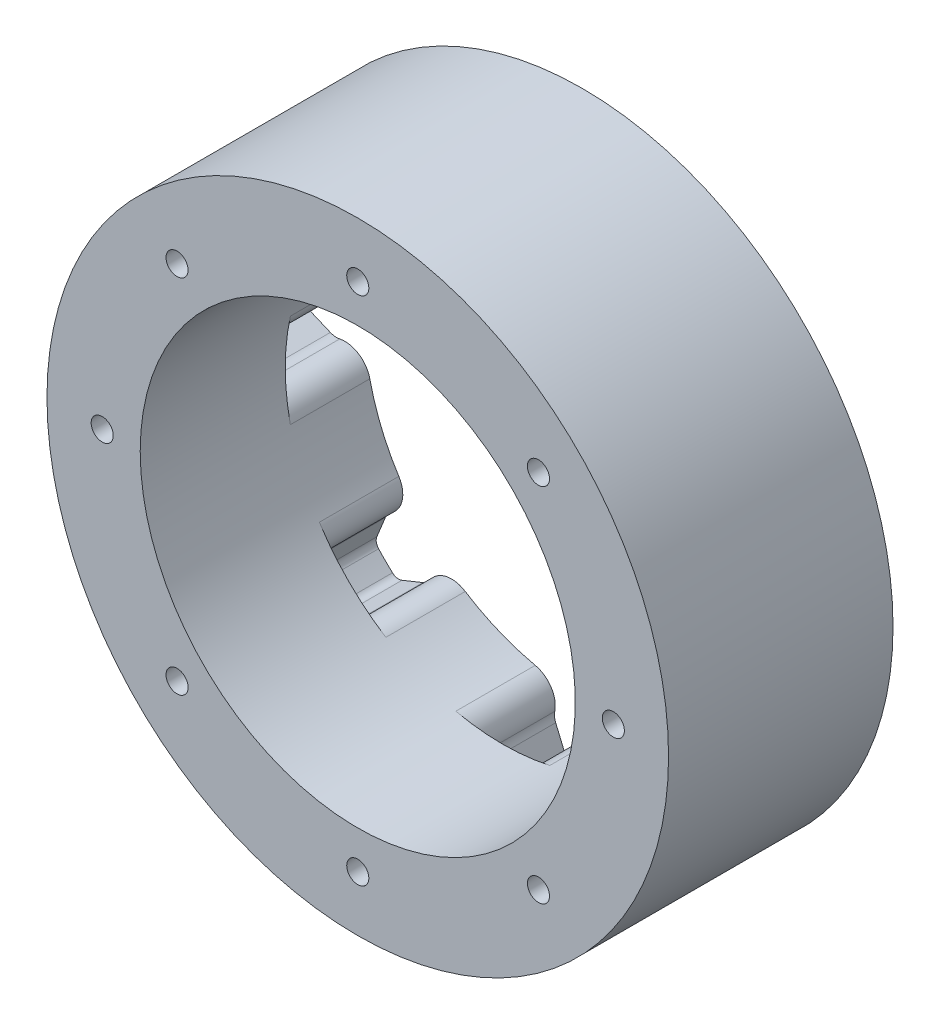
SolidWorks part; units mm, degrees
ref_plane "Front Plane" through (0, 0, 0) normal (1, 0, 0) x (0, 1, 0)
ref_plane "Top Plane" through (0, 0, 0) normal (0, 0, 1) x (0, 1, 0)
ref_plane "Right Plane" through (0, 0, 0) normal (0, 1, 0) x (-1, 0, 0)
sketch "Sketch1" plane through (0, 0, 0) normal (0, 0, 1) x (0, 1, 0)
  circle A0 centre (0, 0) radius 45
  dimension "D1" = 90
extrude "Boss-Extrude1" add sketch "Sketch1" along normal mid plane 32.5
sketch "Sketch2" plane through (0, 0, -16.25) normal (0, 0, -1) x (1, 0, 0)
  line L0 (0, 0) -> (0, 40) construction
  line L1 (-2.2959, 39.365) -> (-3.5687, 36.3529) construction
  line L2 (2.2959, 39.365) -> (3.5687, 36.3529) construction
  line L3 (2.5722, 39.4818) -> (3.8451, 36.4697)
  line L4 (-2.5722, 39.4818) -> (-3.8451, 36.4697)
  circle A0 centre (0, 0) radius 40 construction
  circle A1 centre (0, 0) radius 31.2 construction
  arc A2 (1.41, 39.9751) -> (-1.41, 39.9751) centre (0, 0) ccw construction
  arc A3 (-1.41, 39.9751) -> (-2.2959, 39.365) centre (-1.3747, 38.9758) ccw construction
  arc A4 (-3.5687, 36.3529) -> (-3.6857, 35.1726) centre (-1.7265, 35.5744) ccw construction
  arc A5 (-3.6857, 35.1726) -> (-6.74, 30.4633) centre (-7.6041, 34.3688) cw construction
  arc A6 (3.6857, 35.1726) -> (6.74, 30.4633) centre (7.6041, 34.3688) ccw construction
  arc A7 (3.5687, 36.3529) -> (3.6857, 35.1726) centre (1.7265, 35.5744) cw construction
  arc A8 (1.41, 39.9751) -> (2.2959, 39.365) centre (1.3747, 38.9758) cw construction
  circle A9 centre (0, 0) radius 31.5 construction
  arc A10 (3.9796, 35.1123) -> (6.8048, 30.7562) centre (7.6041, 34.3688) ccw
  arc A11 (3.8451, 36.4697) -> (3.9796, 35.1123) centre (1.7265, 35.5744) cw
  arc A12 (1.4206, 40.275) -> (2.5722, 39.4818) centre (1.3747, 38.9758) cw
  arc A13 (1.4206, 40.275) -> (-1.4206, 40.275) centre (0, 0) ccw
  arc A14 (-1.4206, 40.275) -> (-2.5722, 39.4818) centre (-1.3747, 38.9758) ccw
  arc A15 (-3.8451, 36.4697) -> (-3.9796, 35.1123) centre (-1.7265, 35.5744) ccw
  arc A16 (-3.9796, 35.1123) -> (-6.8048, 30.7562) centre (-7.6041, 34.3688) cw
  arc A17 (-6.8048, 30.7562) -> (6.8048, 30.7562) centre (0, 0) cw
  point P7 (0, 40)
  point P41 (0, 0)
  point P42 (6.7962, 30.7581)
  point P43 (6.8163, 30.7537)
  point P44 (6.8005, 30.7572)
  dimension "D1" = 80
  dimension "D2" = 62.4
  dimension "D3" = 1
  dimension "D4" = 2
  dimension "D6" = 4
  dimension "D9" = 0.3
  dimension "D5" = 3.27
  dimension "D7" = 6.74
  dimension "D8" = 2.82
  dimension "D10" = 0.3
extrude "Cut-Extrude1" cut sketch "Sketch2" against normal blind 11.5
pattern_circular "CirPattern1" count 8 over 360 about axis through (0, 0, 0) along (0, 0, 1) of "Cut-Extrude1"
sketch "Sketch3" plane through (0, 0, -16.25) normal (0, 0, -1) x (1, 0, 0)
  circle A0 centre (0, 0) radius 31.5
  arc A1 (6.8048, 30.7562) -> (-6.8048, 30.7562) centre (0, 0) ccw construction
extrude "Cut-Extrude2" cut sketch "Sketch3" against normal through all
sketch "Sketch4" plane through (0, 0, 16.25) normal (0, 0, 1) x (1, 0, 0)
  circle A0 centre (0, 0) radius 31.15
  dimension "D1" = 62.3
sketch "Sketch5" plane through (0, 0, -4.75) normal (0, 0, -1) x (1, 0, 0)
  line L0 (0, 37) -> (0, 0) construction
  circle A0 centre (0, 37) radius 1.6
  dimension "D1" = 3.2
  dimension "D2" = 37
extrude "Cut-Extrude4" cut sketch "Sketch5" against normal through all
pattern_circular "CirPattern2" count 8 over 360 about axis through (0, 0, 0) along (0, 0, 1) of "Cut-Extrude4"
